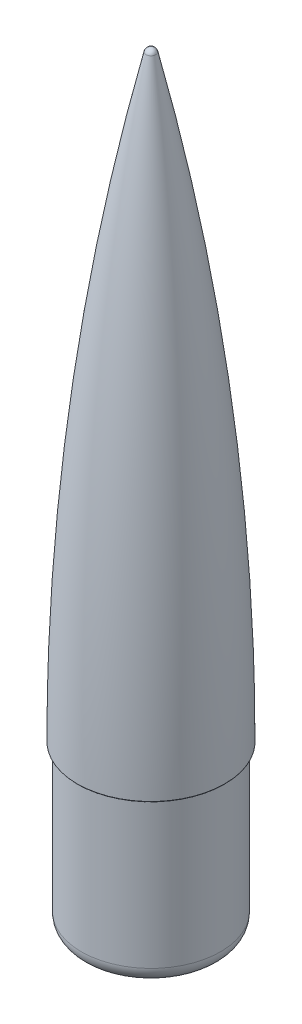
SolidWorks part; units mm, degrees
ref_plane "Front Plane" through (0, 0, 0) normal (0, 0, 1) x (1, 0, 0)
ref_plane "Top Plane" through (0, 0, 0) normal (0, 1, 0) x (1, 0, 0)
ref_plane "Right Plane" through (0, 0, 0) normal (1, 0, 0) x (0, 0, -1)
sketch "Sketch1" plane through (0, 0, 0) normal (0, 0, 1) x (1, 0, 0)
  line L0 (0, 0) -> (0, 31.9059)
  line L1 (0, 234.7068) -> (0, 31.9059)
  line L2 (27.1526, 0) -> (27.1526, -63.5)
  line L3 (27.1526, 0) -> (28.702, 0)
  line L4 (20.8614, -63.5) -> (2.8456, -63.5)
  line L6 (2.8456, -61.468) -> (18.6075, -61.468)
  line L7 (0, 241.3) -> (0, -63.5)
  line L8 (25.1206, -54.9549) -> (25.1206, -9.1639)
  line L9 (25.1206, -9.1639) -> (25.1206, 0)
  line L10 (25.1206, 0) -> (25.1206, 64.0659)
  line L11 (2.8456, -63.5) -> (2.8456, -61.468)
  arc A0 (28.702, 0) -> (1.925, 233.1784) centre (-999.9632, 0) ccw
  arc A1 (25.1206, 64.0659) -> (1.0951, 228.0513) centre (-983.8127, 0) ccw
  arc A2 (1.925, 233.1784) -> (0, 234.7068) centre (0, 232.7303) ccw
  arc A4 (1.0951, 228.0513) -> (0, 228.9218) centre (0, 227.7977) ccw
  arc A7 (20.8614, -63.5) -> (27.1526, -57.2088) centre (20.8614, -57.2088) ccw
  arc A8 (18.6075, -61.468) -> (25.1206, -54.9549) centre (18.6075, -54.9549) ccw
  dimension "D1" = 241.3
  dimension "D2" = 27.1526
  dimension "D3" = 28.702
  dimension "D4" = 63.5
  dimension "D5" = 2.032
  dimension "D6" = 2.032
revolve "Revolve1" add sketch "Sketch1" angle 360 about L7
fillet "Fillet1" radius 0.254 1 edges at (0, 0, 28.702)
